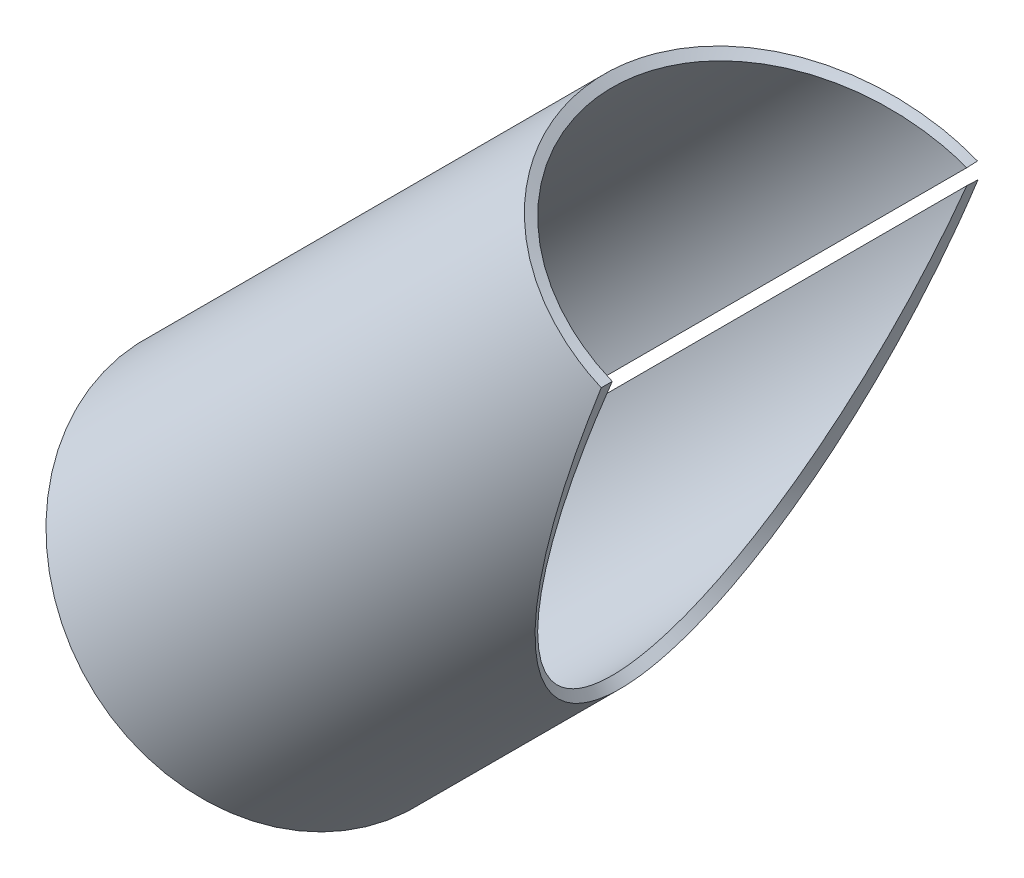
SolidWorks part; units mm, degrees
ref_plane "前视基准面" through (0, 0, 0) normal (0, 0, 1) x (1, 0, 0)
ref_plane "上视基准面" through (0, 0, 0) normal (0, 1, 0) x (1, 0, 0)
ref_plane "右视基准面" through (0, 0, 0) normal (1, 0, 0) x (0, 0, -1)
imported_body "基体零件-任意角度四通管-1"
sheet metal parameters "钣金1" parameters "D1"=0.7366, "厚度"=1
bend "圆角折弯1" bend radius 16.3631 bend angle 356.498 parameters "D5"=1
flatten bends "展开-折弯1"
sketch "尖角-草图1" plane through (-23.3544, -24.0615, -16.3554) normal (-0.0216, 0.0216, 0.9995) x (0.9998, 0.0005, 0.0216)
  line L0 (13.1279, -58.8535) -> (59.201, -12.8019) construction
  dimension "D1" = 0
process bends "加工-折弯1" parameters "D1"=0
sketch "平面-草图1" plane through (0.3536, -0.3536, -16.3554) normal (-0.0216, 0.0216, 0.9995) x (0.9998, 0.0005, 0.0216)
